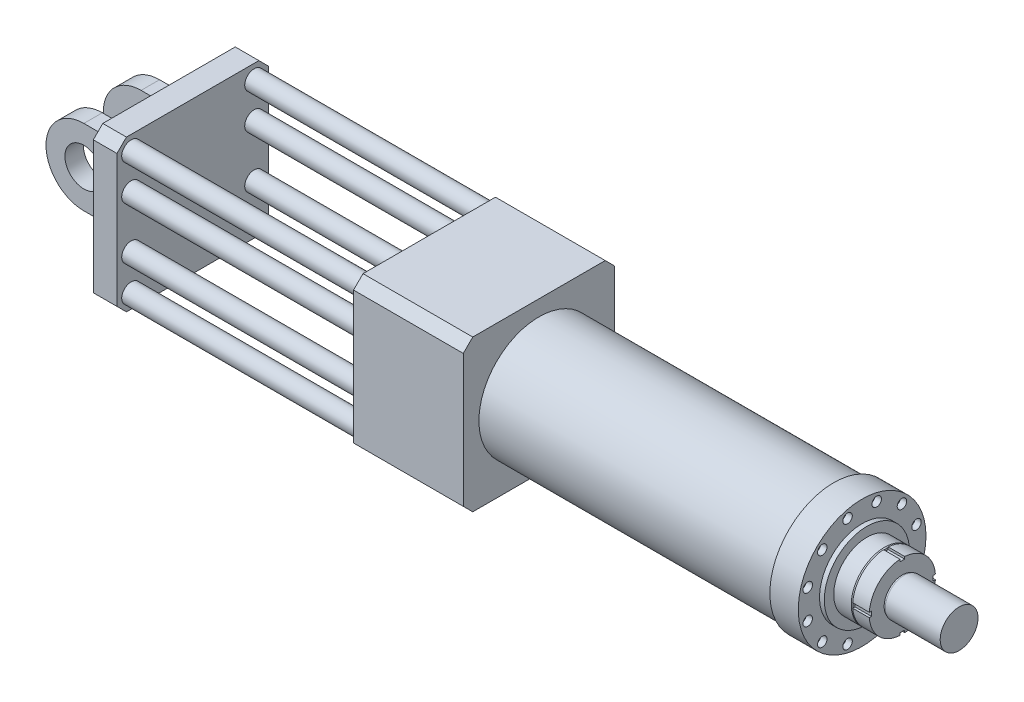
SolidWorks part; units mm, degrees
ref_plane "前视基准面" through (0, 0, 0) normal (0, 0, 1) x (1, 0, 0)
ref_plane "上视基准面" through (0, 0, 0) normal (0, 1, 0) x (1, 0, 0)
ref_plane "右视基准面" through (0, 0, 0) normal (1, 0, 0) x (0, 0, -1)
sketch "草图1" plane through (0, 0, 0) normal (1, 0, 0) x (0, 0, -1)
  circle A0 centre (0, 0) radius 127
  circle A1 centre (0, 0) radius 110
  dimension "D1" = 254
  dimension "D2" = 220
extrude "凸台-拉伸1" add sketch "草图1" along normal blind 623
sketch "草图2" plane through (623, 0, 0) normal (1, 0, 0) x (0, 0, -1)
  line L0 (0, 0) -> (30.7995, 114.9452) construction
  line L2 (0, 0) -> (0, 98.0667) construction
  circle A0 centre (0, 0) radius 135
  circle A1 centre (30.7995, 114.9452) radius 6.5
  circle A2 centre (84.1457, 84.1457) radius 6.5
  circle A3 centre (114.9452, 30.7995) radius 6.5
  circle A4 centre (114.9452, -30.7995) radius 6.5
  circle A5 centre (84.1457, -84.1457) radius 6.5
  circle A6 centre (30.7995, -114.9452) radius 6.5
  circle A7 centre (-30.7995, -114.9452) radius 6.5
  circle A8 centre (-84.1457, -84.1457) radius 6.5
  circle A9 centre (-114.9452, -30.7995) radius 6.5
  circle A10 centre (-114.9452, 30.7995) radius 6.5
  circle A11 centre (-84.1457, 84.1457) radius 6.5
  circle A12 centre (-30.7995, 114.9452) radius 6.5
  point P0 (0, 0)
  point P32 (0, 0)
  dimension "D1" = 270
  dimension "D4" = 12
  dimension "D2" = 119
  dimension "D3" = 15
extrude "凸台-拉伸2" add sketch "草图2" along normal blind 60 separate body
sketch "草图3" plane through (683, 0, 0) normal (1, 0, 0) x (0, 0, -1)
  circle A0 centre (0, 0) radius 90
  dimension "D1" = 180
extrude "凸台-拉伸3" add sketch "草图3" along normal blind 10
sketch "草图5" plane through (693, 0, 0) normal (1, 0, 0) x (0, 0, -1)
  circle A0 centre (0, 0) radius 70
  dimension "D1" = 140
extrude "凸台-拉伸4" add sketch "草图5" along normal blind 40
chamfer "倒角1" distance 3 angle 20 1 edges at (733, 0, -70)
sketch "草图7" plane through (733, 0, 0) normal (1, 0, 0) x (0, 0, -1)
  circle A0 centre (0, 0) radius 70
  dimension "D1" = 140
extrude "凸台-拉伸5" add sketch "草图7" along normal blind 35
sketch "草图8" plane through (768, 0, 0) normal (1, 0, 0) x (0, 0, -1)
  circle A0 centre (0, 0) radius 38.5
  dimension "D1" = 77
extrude "凸台-拉伸6" add sketch "草图8" along normal blind 4
sketch "草图9" plane through (772, 0, 0) normal (1, 0, 0) x (0, 0, -1)
  circle A0 centre (0, 0) radius 40
  dimension "D1" = 80
extrude "凸台-拉伸7" add sketch "草图9" along normal blind 116
sketch "草图10" plane through (768, 0, 0) normal (1, 0, 0) x (0, 0, -1)
  line L0 (-5, -77.2193) -> (-5, -65)
  line L1 (5, -77.2193) -> (5, -65)
  line L2 (-76.4659, 5) -> (-65, 5)
  line L3 (98.9652, -5) -> (65, -5)
  line L4 (-65, 5) -> (-65, -5)
  line L5 (65, 5) -> (65, -5)
  line L6 (-5, 65) -> (5, 65)
  line L7 (-5, -65) -> (5, -65)
  line L8 (-76.4659, 5) -> (-79.4605, -5)
  line L9 (98.9652, 5) -> (98.9652, -5)
  line L10 (-5, 100.6875) -> (5, 100.6875)
  line L11 (-5, -77.2193) -> (5, -77.2193)
  line L12 (5, 65) -> (5, 100.6875)
  line L13 (-5, 65) -> (-5, 100.6875)
  line L15 (-65, -5) -> (-79.4605, -5)
  line L19 (65, 5) -> (98.9652, 5)
  dimension "D1" = 5
  dimension "D2" = 5
  dimension "D3" = 5
  dimension "D4" = 5
  dimension "D5" = 65
  dimension "D6" = 65
  dimension "D7" = 65
  dimension "D8" = 65
extrude "切除-拉伸2" cut sketch "草图10" against normal blind 35 contours L10 L12 L6 L13 | L19 L9 L3 L5 | L0 L7 L1 L11 | L8 L15 L4 L2
sketch "草图11" plane through (0, 0, 0) normal (-1, 0, 0) x (0, 0, 1)
  circle A0 centre (0, 0) radius 130
  dimension "D1" = 260
extrude "凸台-拉伸8" add sketch "草图11" along normal blind 162 separate body
sketch "草图15" plane through (-162, 0, 0) normal (-1, 0, 0) x (0, 0, 1)
  line L5 (-160, 160) -> (160, 160)
  line L6 (-160, 160) -> (-160, -160)
  line L7 (-160, -160) -> (160, -160)
  line L8 (160, 160) -> (160, -160)
  line L9 (-160, 160) -> (160, -160) construction
  line L10 (-160, -160) -> (160, 160) construction
  point P0 (0, 0)
  dimension "D1" = 320
  dimension "D2" = 320
extrude "凸台-拉伸10" add sketch "草图15" along normal blind 70 separate body
sketch "草图16" plane through (-232, 0, 0) normal (-1, 0, 0) x (0, 0, 1)
  circle A0 centre (0, 0) radius 80
  dimension "D1" = 160
extrude "切除-拉伸4" cut sketch "草图16" against normal blind 26
sketch "草图17" plane through (-206, 0, 0) normal (-1, 0, 0) x (0, 0, 1)
  circle A0 centre (0, 0) radius 81.5
  dimension "D1" = 163
extrude "切除-拉伸5" cut sketch "草图17" against normal blind 38
sketch "草图18" plane through (-232, 0, 0) normal (-1, 0, 0) x (0, 0, 1)
  line L0 (0, 0) -> (0, 70.3712) construction
  line L1 (-160, 160) -> (160, 160)
  line L2 (-160, 160) -> (-160, -160)
  line L3 (-160, -160) -> (160, -160)
  line L4 (160, 160) -> (160, -160)
  line L5 (-160, 160) -> (160, -160) construction
  line L6 (-160, -160) -> (160, 160) construction
  point P0 (0, 0)
  dimension "D1" = 320
  dimension "D2" = 320
extrude "凸台-拉伸11" add sketch "草图18" along normal blind 50 from offset 500 separate body
sketch "草图19" plane through (-232, 0, 0) normal (-1, 0, 0) x (0, 0, 1)
  line L0 (0, 0) -> (0, 53.8133) construction
  circle A0 centre (130, 130) radius 20
  circle A1 centre (130, -130) radius 20
  circle A2 centre (-130, -130) radius 20
  circle A3 centre (-130, 130) radius 20
  circle A4 centre (-130, 55) radius 20
  circle A5 centre (-130, -55) radius 20
  circle A6 centre (130, 55) radius 20
  circle A7 centre (130, -55) radius 20
  dimension "D5" = 40
  dimension "D6" = 40
  dimension "D7" = 40
  dimension "D8" = 40
  dimension "D9" = 40
  dimension "D10" = 40
  dimension "D1" = 130
  dimension "D2" = 130
  dimension "D3" = 130
  dimension "D4" = 130
  dimension "D11" = 75
  dimension "D12" = 75
  dimension "D13" = 75
  dimension "D14" = 75
extrude "凸台-拉伸12" add sketch "草图19" along normal blind 500
hole_wizard "孔1" positions "草图21" profile "草图22" legacy
sketch "草图21" plane through (683, 0, 0) normal (1, 0, 0) x (0, 0, -1)
  point P0 (-84.1457, 84.1457)
  point P3 (-30.7995, 114.9452)
  point P6 (30.7995, 114.9452)
  point P9 (84.1457, 84.1457)
  point P12 (114.9452, 30.7995)
  point P15 (114.9452, -30.7995)
  point P18 (84.1457, -84.1457)
  point P21 (30.7995, -114.9452)
  point P24 (-30.7995, -114.9452)
  point P27 (-84.1457, -84.1457)
  point P30 (-114.9452, -30.7995)
  point P33 (-114.9452, 30.7995)
sketch "草图22" plane through (683, 84.1457, 84.1457) normal (0, 1, 0) x (0, 0, -1)
  line L0 (0, 0) -> (0, 13)
  line L1 (0, 13) -> (10, 13)
  line L2 (10, 13) -> (10, 0)
  line L3 (10, 0) -> (0, 0)
  line L4 (0, 110) -> (0, -10) construction
  dimension "直径" = 20
  dimension "深度" = 13
sketch "草图23" plane through (-782, 0, 0) normal (-1, 0, 0) x (0, 0, 1)
  line L0 (-60.5, 0) -> (60.5, 0) construction
  line L2 (-80, 80) -> (-41, 80)
  line L3 (-80, 80) -> (-80, -80)
  line L4 (-80, -80) -> (-41, -80)
  line L5 (-41, 80) -> (-41, -80)
  line L6 (-80, 80) -> (-41, -80) construction
  line L7 (-80, -80) -> (-41, 80) construction
  line L8 (41, 80) -> (80, 80)
  line L9 (41, 80) -> (41, -80)
  line L10 (41, -80) -> (80, -80)
  line L11 (80, 80) -> (80, -80)
  line L12 (41, 80) -> (80, -80) construction
  line L13 (41, -80) -> (80, 80) construction
  point P4 (0, 0)
  dimension "D1" = 82
  dimension "D2" = 160
  dimension "D3" = 39
  dimension "D4" = 39
  dimension "D5" = 160
  dimension "D6" = 160
extrude "凸台-拉伸13" add sketch "草图23" along normal blind 180
sketch "草图24" plane through (0, 0, 80) normal (0, 0, 1) x (1, 0, 0)
  line L0 (-962, 0) -> (-882, 0) construction
  line L1 (-962, -80) -> (-962, 80) construction
  line L2 (-882, 80) -> (-1066.4537, 143.033)
  line L3 (-1066.4537, 143.033) -> (-1039.5996, -152.4302)
  line L4 (-1039.5996, -152.4302) -> (-882, -80)
  arc A0 (-882, 80) -> (-882, -80) centre (-882, 0) ccw
  circle A1 centre (-882, 0) radius 40
  dimension "D2" = 80
  dimension "D1" = 80
extrude "切除-拉伸6" cut sketch "草图24" against normal blind 180
chamfer "倒角2" distance 20 angle 45 4 edges at (-197, -160, -160) (-197, -160, 160) (-197, 160, -160) (-197, 160, 160)
chamfer "倒角3" distance 10 angle 45 8 edges at (-782, 0, -41) (-782, 80, -60.5) (-782, -80, -60.5) (-782, 0, -80) (-782, 0, 41) (-782, -80, 60.5) (-782, 0, 80) (-782, 80, 60.5)
chamfer "倒角4" distance 20 angle 45 4 edges at (-757, -160, -160) (-757, 160, -160) (-757, -160, 160) (-757, 160, 160)
sketch "草图25" plane through (-162, 0, 0) normal (1, 0, 0) x (0, 0, -1)
  line L0 (160, 140) -> (140, 160) construction
  line L1 (160, 140) -> (160, -140) construction
  line L2 (140, -160) -> (160, -140) construction
  line L3 (140, -160) -> (-140, -160) construction
  line L4 (-160, -140) -> (-140, -160) construction
  line L5 (-160, -140) -> (-160, 140) construction
  line L6 (-140, 160) -> (-160, 140) construction
  line L7 (-140, 160) -> (140, 160) construction
  line L8 (160, 140) -> (140, 160)
  line L9 (160, 140) -> (160, -140)
  line L10 (140, -160) -> (160, -140)
  line L11 (140, -160) -> (-140, -160)
  line L12 (-160, -140) -> (-140, -160)
  line L13 (-160, -140) -> (-160, 140)
  line L14 (-140, 160) -> (-160, 140)
  line L15 (-140, 160) -> (140, 160)
extrude "凸台-拉伸14" add sketch "草图25" along normal blind 162
